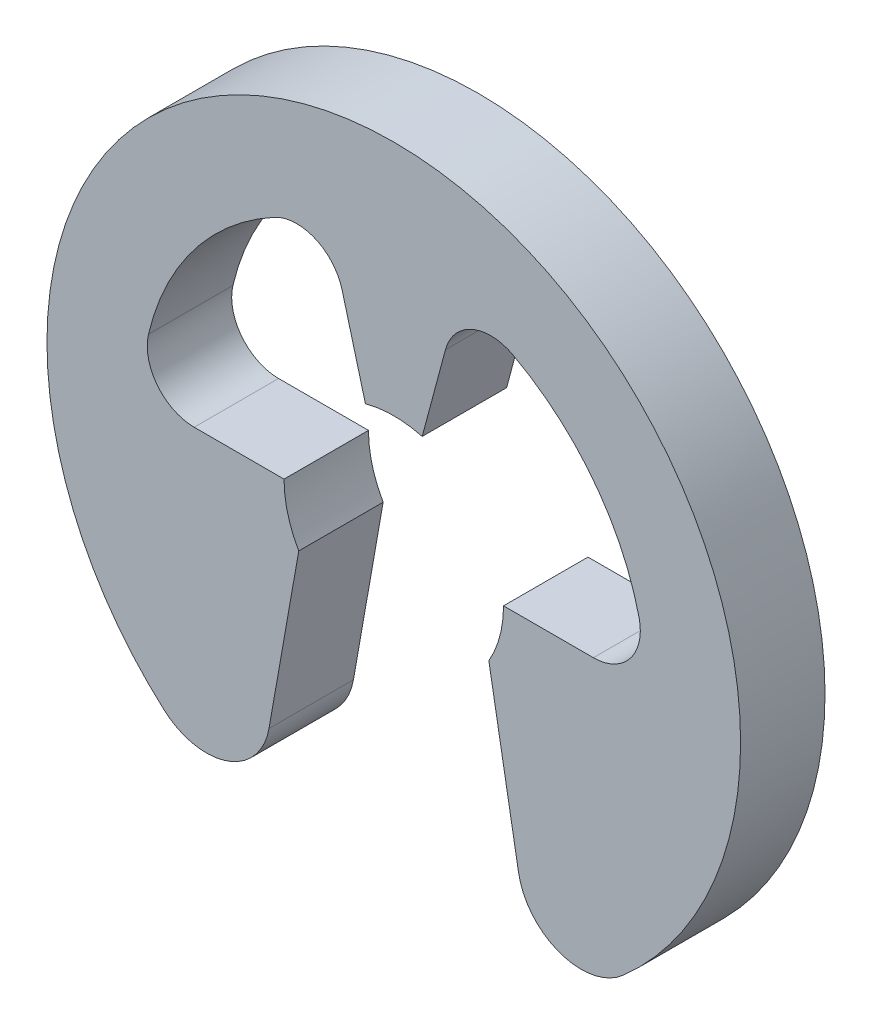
SolidWorks part; units mm, degrees
ref_plane "Plane1" through (0, 0, 0) normal (0, 0, 1) x (1, 0, 0)
ref_plane "Plane2" through (0, 0, 0) normal (0, 1, 0) x (1, 0, 0)
ref_plane "Plane3" through (0, 0, 0) normal (1, 0, 0) x (0, 0, -1)
sketch "Clipboard" plane through (0, 0, 0) normal (0, 0, 1) x (1, 0, 0)
  line L0 (0, 0) -> (0.2853, 0)
  circle A0 centre (0, 0) radius 0.3175
  circle A1 centre (0, 0) radius 1.0033
  dimension "FreeID" = 0.635
  dimension "FreeOD" = 2.0066
  dimension "Bridge" = 0.2853
sketch "BodySke" plane through (0, 0, 0) normal (0, 0, 1) x (1, 0, 0)
  line L0 (-0.7581, 0) -> (0.7581, 0) construction
  line L1 (0, 0) -> (0, 0.3302) construction
  line L2 (0, 0) -> (0.1962, 0.7323) construction
  line L3 (0, 0) -> (0.286, -0.1651) construction
  line L4 (0, 0) -> (-0.1962, 0.7323) construction
  line L5 (0, 0) -> (-0.286, -0.1651) construction
  line L6 (0.286, -0.1651) -> (0.3754, -0.6725)
  line L7 (-0.286, -0.1651) -> (-0.3754, -0.6725)
  line L9 (0.3302, 0) -> (0.6005, 0)
  line L10 (-0.3302, 0) -> (-0.6005, 0)
  line L11 (0.0855, 0.3189) -> (0.1554, 0.5801)
  line L12 (-0.0855, 0.3189) -> (-0.1554, 0.5801)
  circle A0 centre (0, 0) radius 0.3302 construction
  arc A1 (0.738, 0.1735) -> (0.3586, 0.6679) centre (0, 0) ccw
  arc A2 (0.6901, -0.7826) -> (-0.6901, -0.7826) centre (0, 0) ccw
  arc A3 (0.286, -0.1651) -> (0.3302, 0) centre (0, 0) ccw
  arc A4 (-0.3586, 0.6679) -> (-0.738, 0.1735) centre (0, 0) ccw
  arc A5 (-0.3302, 0) -> (-0.286, -0.1651) centre (0, 0) ccw
  arc A6 (-0.0855, 0.3189) -> (0.0855, 0.3189) centre (0, 0) cw
  arc A7 (0.3586, 0.6679) -> (0.1554, 0.5801) centre (0.2918, 0.5435) ccw
  arc A8 (0.3754, -0.6725) -> (0.6901, -0.7826) centre (0.5637, -0.6393) ccw
  arc A9 (-0.6901, -0.7826) -> (-0.3754, -0.6725) centre (-0.5637, -0.6393) ccw
  arc A10 (-0.738, 0.1735) -> (-0.6005, 0) centre (-0.6005, 0.1412) ccw
  arc A11 (-0.1554, 0.5801) -> (-0.3586, 0.6679) centre (-0.2918, 0.5435) ccw
  arc A12 (0.6005, 0) -> (0.738, 0.1735) centre (0.6005, 0.1412) ccw
  dimension "D1" = 30
  dimension "GrooveDia" = 0.6604
  dimension "OutsideDia" = 2.0869
  dimension "D3" = 30
  dimension "TipRad" = 0.1911
  dimension "CavityDia" = 1.5163
  dimension "CavityFilletRad" = 0.1412
  dimension "D4" = 20
extrude "Body" add sketch "BodySke" against normal blind 0.254
equation "' \"FreeID@Clipboard\" = 0.025"
equation "' \"Thickness@Body\" = 0.01"
equation "' \"GrooveDia@BodySke\" = 0.026"
equation "' \"FreeOD@Clipboard\" = 0.079"
equation "' \"FreeID@Clipboard\" = 1.213"
equation "' \"Thickness@Body\" = 0.062"
equation "' \"GrooveDia@BodySke\" = 1.23"
equation "' \"FreeOD@Clipboard\" = 1.875"
equation "\"OutsideDia@BodySke\" = ( \"GrooveDia@BodySke\"  /  \"FreeID@Clipboard\" )  * \"FreeOD@Clipboard\""
equation "\"Bridge@Clipboard\" =  (\"OutsideDia@BodySke\" - \"GrooveDia@BodySke\") / 2 * 0.4"
equation "\"CavityDia@BodySke\" = \"OutsideDia@BodySke\"  - 2 * \"Bridge@Clipboard\""
equation "\"CavityFilletRad@BodySke\" =  (\"CavityDia@BodySke\" - \"GrooveDia@BodySke\") / 2 * 0.33"
equation "\"TipRad@BodySke\" = 0.67 * \"Bridge@Clipboard\""
